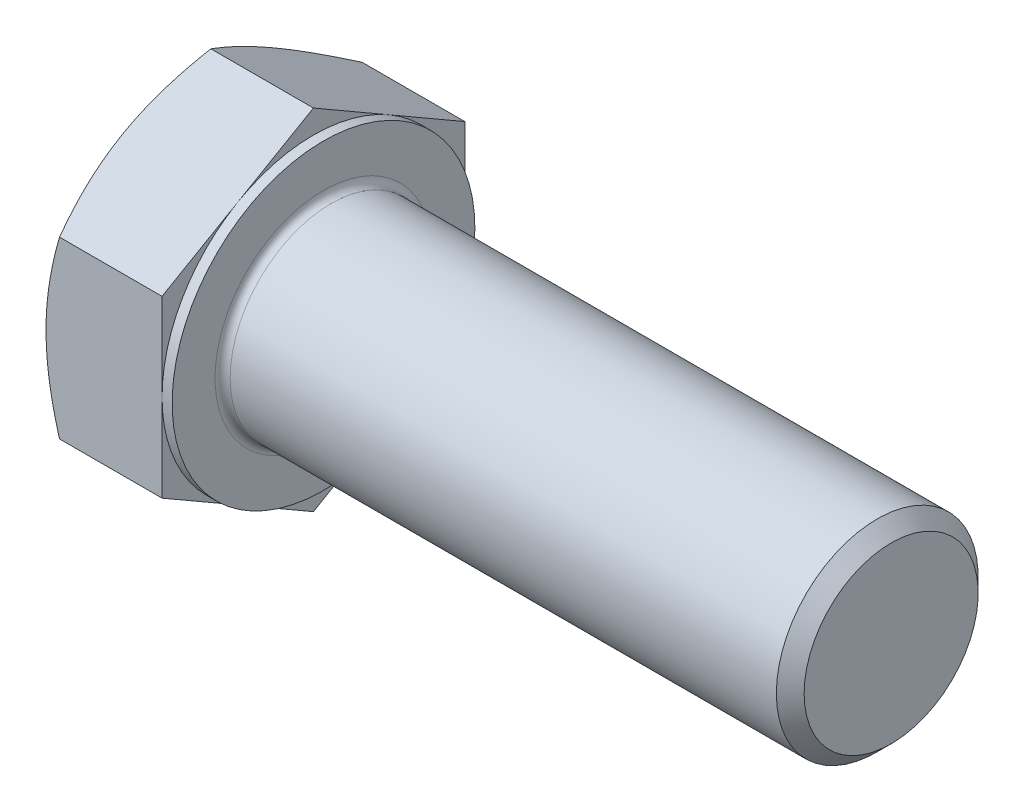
SolidWorks part; units mm, degrees
ref_plane "Plane1" through (0, 0, 0) normal (0, 0, 1) x (1, 0, 0)
ref_plane "Plane2" through (0, 0, 0) normal (0, 1, 0) x (1, 0, 0)
ref_plane "Plane3" through (0, 0, 0) normal (1, 0, 0) x (0, 0, -1)
sketch "Sketch1" plane through (0, 0, 0) normal (1, 0, 0) x (0, 0, -1)
  line L0 (12, 6.9282) -> (12, -6.9282)
  line L1 (-12, 6.9282) -> (-12, -6.9282)
  line L2 (12, -6.9282) -> (0, -13.8564)
  line L3 (0, -13.8564) -> (-12, -6.9282)
  line L4 (12, 6.9282) -> (0, 13.8564)
  line L5 (0, 13.8564) -> (-12, 6.9282)
  dimension "Width_flats" = 24
  dimension "D2" = 120
  dimension "D3" = 12
  dimension "D4" = 12
  dimension "D5" = 12
extrude "BaseHead" add sketch "Sketch1" along normal blind 10
sketch "BodySke" plane through (0, 0, 0) normal (0, 0, 1) x (1, 0, 0)
  line L0 (0, 6.9282) -> (0, -6.9282) construction
  line L1 (0, 0) -> (55, 0)
  line L2 (0, 0) -> (0, 8)
  line L3 (0, 8) -> (53.8985, 8)
  line L4 (55, 0) -> (55, 6.8985)
  line L5 (10, 13.8564) -> (10, 6.9282) construction
  line L6 (55, 6.8985) -> (53.8985, 8)
  line L7 (0, 0) -> (96.52, 0) construction
  line L8 (55, -6.8985) -> (53.8985, -8) construction
  line L9 (0, -8) -> (53.8985, -8) construction
  line L10 (12, 15.24) -> (12, -1.27) construction
  line L12 (10, 6.9282) -> (10, -6.9282) construction
  dimension "Length" = 45
  dimension "Body_ch_ang" = 45
  dimension "Diameter" = 16
  dimension "Minor_dia" = 13.797
  dimension "Advance" = 2
revolve "BaseBody" add sketch "BodySke"
fillet "HeadFillet" radius 0.6 1 edges at (10, 0, -8)
sketch "Sketch3" plane through (0, 0, 0) normal (0, 0, 1) x (1, 0, 0)
  line L0 (0, 12) -> (3.9585, 18.8564)
  line L1 (0, 13.8564) -> (0, 6.9282) construction
  line L2 (3.9585, 18.8564) -> (3.9585, 23.8564)
  line L3 (3.9585, 23.8564) -> (-10, 23.8564)
  line L4 (-10, 23.8564) -> (-10, 12)
  line L5 (-10, 12) -> (0, 12)
  line L6 (0, 0) -> (99.06, 0) construction
  line L7 (10, 13.8564) -> (0, 13.8564) construction
  dimension "D1" = 12
  dimension "D2" = 5
  dimension "D3" = 10
  dimension "D4" = 5
  dimension "Head_ch_ang" = 30
revolve "HeadChamfer" cut sketch "Sketch3" angle 360 about L6
sketch "Sketch4" plane through (0, 0, 0) normal (0, 0, 1) x (1, 0, 0)
  line L1 (10, 13.8564) -> (10, 6.9282) construction
  line L2 (10, 12) -> (9.2, 12)
  line L3 (10, 12) -> (10, 23.8564)
  line L4 (10, 23.8564) -> (9.2, 23.8564)
  line L5 (0, 0) -> (95.25, 0) construction
  line L6 (0, 0) -> (96.52, 0) construction
  line L7 (9.2, 12) -> (9.2, 23.8564)
  line L8 (10, 13.8564) -> (1.0718, 13.8564) construction
  dimension "D1" = 24
  dimension "D2" = 10
  dimension "Bearing_ht" = 0.8
revolve "BearingFace" cut sketch "Sketch4" angle 360 about L5
sketch "ThdSchSke" plane through (0, 0, 0) normal (0, 0, 1) x (1, 0, 0)
  line L0 (12, -6.8985) -> (11.2287, -8)
  line L1 (12, -6.8985) -> (12.7713, -8)
  line L2 (12.7713, -8) -> (12.7713, -10)
  line L3 (-3.175, 0) -> (5.1513, 0) construction
  line L5 (12.7713, -10) -> (11.2287, -10)
  line L6 (11.2287, -10) -> (11.2287, -8)
  dimension "Thread_minor" = 13.797
  dimension "Diameter" = 16
  dimension "Start" = 12
  dimension "SideAngle" = 55
  dimension "VeeAngle" = 70
  dimension "Overcut" = 20
revolve "ThreadSchematic" [suppressed] cut sketch "ThdSchSke" angle 360 about L3
pattern_linear "ThdSchPat" [suppressed]
equation "\"D3@Sketch1\" = \"Width_flats@Sketch1\" / 2"
equation "\"D4@Sketch1\" = \"D3@Sketch1\""
equation "\"D5@Sketch1\" = \"D4@Sketch1\""
equation "\"Thread_minor@ThreadCosmetic\" = \"Minor_dia@BodySke\""
equation "\"D1@Sketch3\" = \"Width_flats@Sketch1\" / 2"
equation "\"D1@Sketch4\" = \"Width_flats@Sketch1\""
equation "\"Thread_length@ThreadCosmetic\" = \"Length@BodySke\" - \"Advance@BodySke\""
equation "\"Thread_minor@ThdSchSke\" = \"Minor_dia@BodySke\""
equation "\"Diameter@ThdSchSke\" = \"Diameter@BodySke\""
equation "\"Overcut@ThdSchSke\" = \"Diameter@BodySke\" * 1.25"
equation "\"Start@ThdSchSke\" = \"Head_ht@BaseHead\" + \"Length@BodySke\" - \"Thread_length@ThreadCosmetic\"  '---Non-countersunk---"
equation "\"Num_threads@ThdSchPat\" = int( \"Thread_length@ThreadCosmetic\" / \"Advance@BodySke\" + 0.999 )  + 1"
equation "\"Advance@ThdSchPat\" = \"Thread_length@ThreadCosmetic\" /  (\"Num_threads@ThdSchPat\" - 1) 'relax it"
equation "\"Num_threads@ThdSchPat\" = \"Num_threads@ThdSchPat\" - sgn( \"Num_threads@ThdSchPat\" - 1) '---chamfered tips only---"
